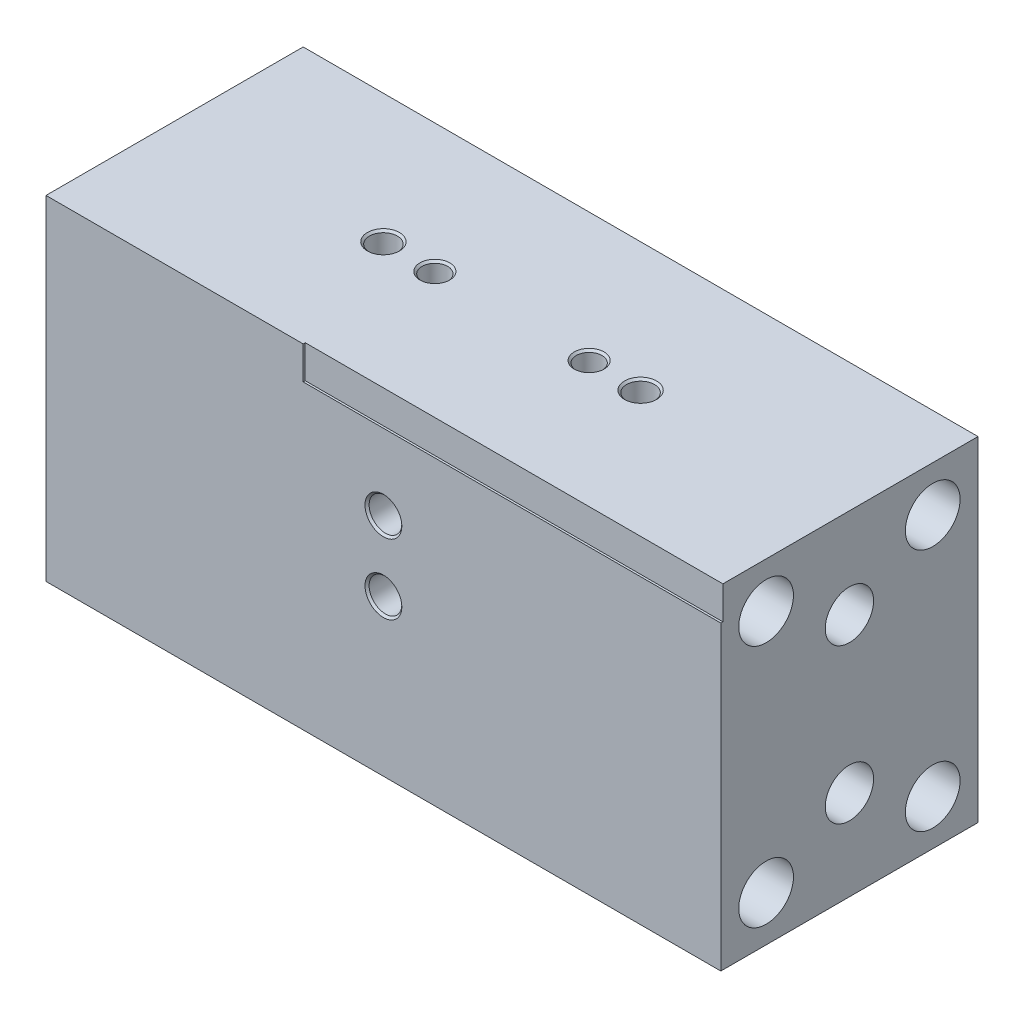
SolidWorks part; units mm, degrees
ref_plane "Front Plane" through (0, 0, 0) normal (0, 0, 1) x (1, 0, 0)
ref_plane "Top Plane" through (0, 0, 0) normal (0, 1, 0) x (1, 0, 0)
ref_plane "Right Plane" through (0, 0, 0) normal (1, 0, 0) x (0, 0, -1)
sketch "Sketch1" plane through (0, 0, 0) normal (0, 0, 1) x (1, 0, 0)
  line L0 (-41.656, -20.6375) -> (41.656, -20.6375)
  line L1 (41.656, -20.6375) -> (41.656, 20.6375)
  line L2 (41.656, 20.6375) -> (-41.656, 20.6375)
  line L3 (-41.656, 20.6375) -> (-41.656, -20.6375)
  line L4 (-41.656, 20.6375) -> (41.656, -20.6375) construction
  dimension "D1" = 83.312
  dimension "D2" = 41.275
extrude "Extrude1" add sketch "Sketch1" along normal mid plane 31.75
sketch "Sketch18" plane through (41.656, 0, 0) normal (1, 0, 0) x (0, 0, -1)
  line L0 (-15.875, 20.6375) -> (-15.875, 16.5735)
  line L1 (-15.875, 16.5735) -> (-15.621, 16.5735)
  line L2 (-15.621, 16.5735) -> (-15.621, 20.6375)
  line L3 (-15.621, 20.6375) -> (-15.875, 20.6375)
  line L4 (-15.875, 20.6375) -> (15.875, 20.6375) construction
  line L5 (-15.875, -20.6375) -> (-15.875, 20.6375) construction
  dimension "D1" = 4.064
  dimension "D2" = 0.254
extrude "Cut-Extrude1" cut sketch "Sketch18" against normal blind 51.562
hole_wizard "#8-32 Tapped Hole1" positions "Sketch20" profile "Sketch19" tap size "#8-32" standard "ANSI Inch"
sketch "Sketch20" plane through (0, 20.6375, 0) normal (0, 1, 0) x (1, 0, 0)
  line L0 (-15.875, 0) -> (15.875, 0) construction
  point P0 (-15.875, 0)
  point P2 (15.875, 0)
  dimension "D1" = 31.75
sketch "Sketch19" plane through (-15.875, 20.6375, 0) normal (1, 0, 0) x (0, 0, 1)
  line L0 (0, 0) -> (0, 11.3502)
  line L1 (0, 11.3502) -> (1.7272, 10.3124)
  line L2 (1.7272, 10.3124) -> (1.7272, 0)
  line L5 (1.7272, 0) -> (0, 0)
  line L10 (0, 11.3502) -> (-1.7272, 10.3124) construction
  line L11 (0, -6.35) -> (0, 107.95) construction
  dimension "Tap Drill Dia." = 3.4544
  dimension "Tap Drill Depth" = 10.3124
  dimension "Drill Angle" = 118
hole_wizard "Hole1" positions "Sketch22" profile "Sketch21" legacy
sketch "Sketch22" plane through (0, 20.6375, 0) normal (0, 1, 0) x (1, 0, 0)
  line L0 (-9.525, 0) -> (9.525, 0) construction
  point P0 (-9.525, 0)
  point P2 (9.525, 0)
  dimension "D1" = 19.05
sketch "Sketch21" plane through (-9.525, 20.6375, 0) normal (1, 0, 0) x (0, 0, 1)
  line L0 (0, 0) -> (0, 7.3039)
  line L1 (0, 7.3039) -> (1.5875, 6.35)
  line L2 (1.5875, 6.35) -> (1.5875, 0)
  line L4 (1.5875, 0) -> (0, 0)
  line L6 (0, 7.3039) -> (-1.5875, 6.35) construction
  line L7 (0, -4.2442) -> (0, 117.3081) construction
  dimension "Diameter" = 3.175
  dimension "Depth" = 6.35
  dimension "Drill Angle" = 118
hole_wizard "#10-32 Tapped Hole1" positions "Sketch24" profile "Sketch23" tap size "#10-32" standard "ANSI Inch"
sketch "Sketch24" plane through (0, 0, 15.875) normal (0, 0, 1) x (1, 0, 0)
  point P0 (0, 7.239)
  point P2 (0, -1.397)
  dimension "D1" = 8.636
  dimension "D2" = 1.397
sketch "Sketch23" plane through (0, 7.239, 15.875) normal (1, 0, 0) x (0, -1, 0)
  line L0 (0, 0) -> (0, 10.7637)
  line L1 (0, 10.7637) -> (2.0193, 9.5504)
  line L2 (2.0193, 9.5504) -> (2.0193, 0)
  line L5 (2.0193, 0) -> (0, 0)
  line L10 (0, 10.7637) -> (-2.0193, 9.5504) construction
  line L11 (0, -6.35) -> (0, 107.95) construction
  dimension "Tap Drill Dia." = 4.0386
  dimension "Tap Drill Depth" = 9.5504
  dimension "Drill Angle" = 118
hole_wizard "#8-32 Tapped Hole2" positions "Sketch26" profile "Sketch25" tap size "#8-32" standard "ANSI Inch"
sketch "Sketch26" plane through (0, 0, -15.875) normal (0, 0, -1) x (-1, 0, 0)
  line L0 (-15.875, 0) -> (15.875, 0) construction
  point P0 (-15.875, 0)
  point P2 (15.875, 0)
  dimension "D1" = 31.75
sketch "Sketch25" plane through (15.875, 0, -15.875) normal (1, 0, 0) x (0, 1, 0)
  line L0 (0, 0) -> (0, 11.3502)
  line L1 (0, 11.3502) -> (1.7272, 10.3124)
  line L2 (1.7272, 10.3124) -> (1.7272, 0)
  line L5 (1.7272, 0) -> (0, 0)
  line L10 (0, 11.3502) -> (-1.7272, 10.3124) construction
  line L11 (0, -6.35) -> (0, 107.95) construction
  dimension "Tap Drill Dia." = 3.4544
  dimension "Tap Drill Depth" = 10.3124
  dimension "Drill Angle" = 118
hole_wizard "Hole2" positions "Sketch28" profile "Sketch27" legacy
sketch "Sketch28" plane through (0, 0, -15.875) normal (0, 0, -1) x (-1, 0, 0)
  line L0 (-9.525, 0) -> (9.525, 0) construction
  point P0 (-9.525, 0)
  point P2 (9.525, 0)
  dimension "D1" = 19.05
sketch "Sketch27" plane through (9.525, 0, -15.875) normal (1, 0, 0) x (0, 1, 0)
  line L0 (0, 0) -> (0, 7.3039)
  line L1 (0, 7.3039) -> (1.5875, 6.35)
  line L2 (1.5875, 6.35) -> (1.5875, 0)
  line L4 (1.5875, 0) -> (0, 0)
  line L6 (0, 7.3039) -> (-1.5875, 6.35) construction
  line L7 (0, -4.2442) -> (0, 117.3081) construction
  dimension "Diameter" = 3.175
  dimension "Depth" = 6.35
  dimension "Drill Angle" = 118
sketch "Sketch29" plane through (41.656, 0, 0) normal (1, 0, 0) x (0, 0, -1)
  line L0 (-10.287, 15.0495) -> (10.287, -15.0495) construction
  line L1 (0, 9.525) -> (0, -9.525) construction
  circle A0 centre (-10.287, 15.0495) radius 3.3782
  circle A1 centre (10.287, 15.0495) radius 3.3782
  circle A2 centre (-10.287, -15.0495) radius 3.3782
  circle A3 centre (10.287, -15.0495) radius 3.3782
  circle A4 centre (0, 9.525) radius 2.9845
  circle A5 centre (0, -9.525) radius 2.9845
  dimension "D1" = 30.099
  dimension "D2" = 20.574
  dimension "D3" = 6.7564
  dimension "D4" = 5.969
  dimension "D5" = 19.05
extrude "Cut-Extrude2" cut sketch "Sketch29" against normal through all
chamfer "Chamfer1" distance 0.254 angle 45 10 edges at (-17.6022, 0, -15.875) (-11.1125, 0, -15.875) (7.9375, 0, -15.875) (14.1478, 0, -15.875) (2.0193, -1.397, 15.875) (2.0193, 7.239, 15.875) (15.875, 20.6375, 1.7272) (9.525, 20.6375, 1.5875) (-9.525, 20.6375, 1.5875) (-15.875, 20.6375, 1.7272)
